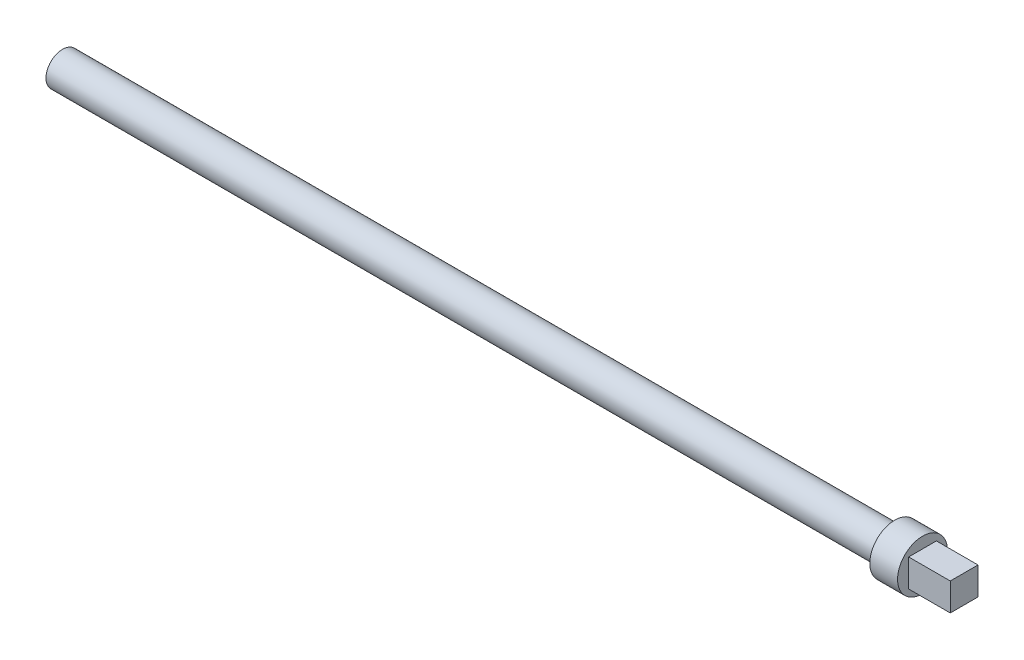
SolidWorks part; units mm, degrees
ref_plane "Front" through (0, 0, 0) normal (0, 0, 1) x (1, 0, 0)
ref_plane "Top" through (0, 0, 0) normal (0, 1, 0) x (1, 0, 0)
ref_plane "Right" through (0, 0, 0) normal (1, 0, 0) x (0, 0, -1)
sketch "Sketch1" plane through (0, 0, 0) normal (1, 0, 0) x (0, 0, -1)
  circle A0 centre (0, 0) radius 6
  dimension "D1" = 12
extrude "Boss-Extrude1" add sketch "Sketch1" along normal mid plane 300
sketch "Sketch2" plane through (150, 0, 0) normal (1, 0, 0) x (0, 0, -1)
  circle A0 centre (0, 0) radius 9
  dimension "D1" = 18
extrude "Boss-Extrude2" add sketch "Sketch2" along normal blind 10
sketch "Sketch3" plane through (160, 0, 0) normal (1, 0, 0) x (0, 0, -1)
  line L1 (-5, 5) -> (5, 5)
  line L2 (-5, 5) -> (-5, -5)
  line L3 (-5, -5) -> (5, -5)
  line L4 (5, 5) -> (5, -5)
  line L5 (-5, 5) -> (5, -5) construction
  line L6 (-5, -5) -> (5, 5) construction
  point P0 (0, 0)
  dimension "D1" = 10
  dimension "D2" = 10
extrude "Boss-Extrude3" add sketch "Sketch3" along normal blind 15
